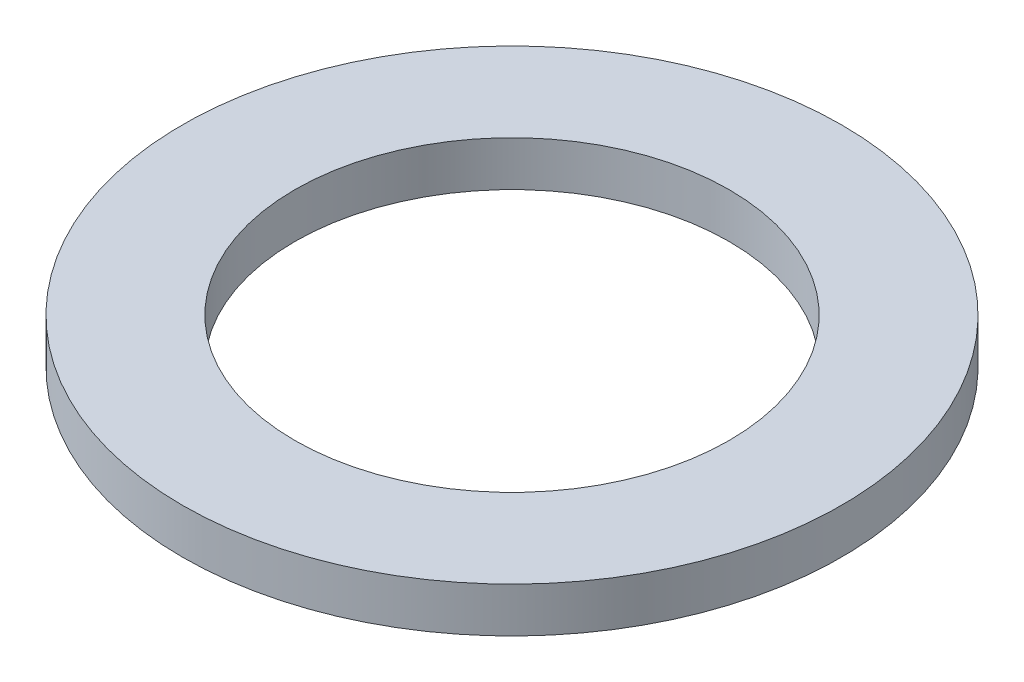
SolidWorks part; units mm, degrees
ref_plane "Face" through (0, 0, 0) normal (0, 0, 1) x (1, 0, 0)
ref_plane "Dessus" through (0, 0, 0) normal (0, 1, 0) x (1, 0, 0)
ref_plane "Droite" through (0, 0, 0) normal (1, 0, 0) x (0, 0, -1)
sketch "Esquisse1" plane through (0, 0, 0) normal (0, 0, 1) x (1, 0, 0)
  line L0 (0, 0) -> (0, 30.0066) construction
  line L1 (7.25, 0) -> (11, 0)
  line L2 (7.25, 0) -> (7.25, 1.5)
  line L3 (7.25, 1.5) -> (11, 1.5)
  line L4 (11, 0) -> (11, 1.5)
  dimension "D1" = 14.5
  dimension "D2" = 22
  dimension "D3" = 1.5
revolve "Révolution1" add sketch "Esquisse1" angle 360 about L0
